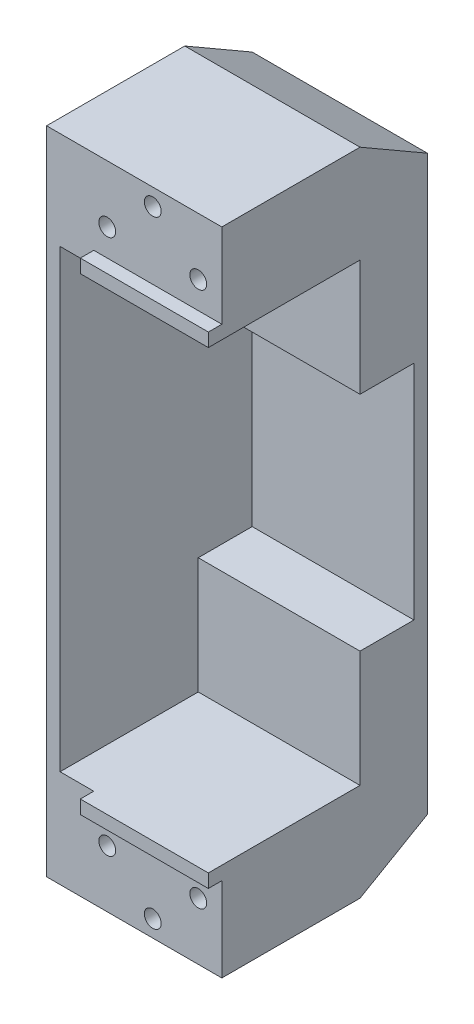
SolidWorks part; units mm, degrees
ref_plane "Спереди" through (0, 0, 0) normal (0, 0, 1) x (1, 0, 0)
ref_plane "Сверху" through (0, 0, 0) normal (0, 1, 0) x (1, 0, 0)
ref_plane "Справа" through (0, 0, 0) normal (1, 0, 0) x (0, 0, -1)
sketch "Эскиз1" plane through (0, 0, 0) normal (0, 1, 0) x (1, 0, 0)
  line L1 (-52, 0) -> (0, 0)
  line L2 (-52, 0) -> (-52, 61)
  line L3 (-52, 61) -> (0, 61)
  line L4 (0, 0) -> (0, 61)
  line L5 (-52, 0) -> (0, 61) construction
  line L6 (-52, 61) -> (0, 0) construction
  point P0 (0, 0)
  dimension "D1" = 61
  dimension "D2" = 52
extrude "Бобышка-Вытянуть1" add sketch "Эскиз1" against normal blind 29
sketch "Эскиз2" plane through (0, 0, 0) normal (0, 0, 1) x (1, 0, 0)
  line L1 (0, -29) -> (-38, -29)
  line L2 (0, -29) -> (0, -25)
  line L3 (0, -25) -> (-38, -25)
  line L4 (-38, -29) -> (-38, -25)
  dimension "D1" = 38
  dimension "D2" = 4
extrude "Бобышка-Вытянуть2" add sketch "Эскиз2" along normal blind 4
hole_wizard "Отверстие обработанное метчиком M6x1.01" positions "Эскиз3" profile "Эскиз4" tap size "M6x1.0" standard "Ansi Metric"
sketch "Эскиз3" plane through (0, 0, 0) normal (0, 0, 1) x (1, 0, 0)
  line L0 (-34, -17) -> (-7, -17) construction
  line L2 (-20.5, -17) -> (-20.5, -5) construction
  line L4 (-38, -29) -> (0, -29) construction
  line L5 (0, -25) -> (0, 0) construction
  point P0 (-34, -17)
  point P4 (-7, -17)
  point P8 (-20.5, -5)
  dimension "D1" = 27
  dimension "D2" = 12
  dimension "D3" = 12
  dimension "D4" = 7
sketch "Эскиз4" plane through (-34, -17, 0) normal (1, 0, 0) x (0, -1, 0)
  line L0 (0, 0) -> (0, 21.5022)
  line L1 (0, 21.5022) -> (2.5, 20)
  line L2 (2.5, 20) -> (2.5, 0)
  line L5 (2.5, 0) -> (0, 0)
  line L10 (0, 21.5022) -> (-2.5, 20) construction
  line L11 (0, -6.35) -> (0, 107.95) construction
  dimension "Диаметр сверла" = 5
  dimension "Глубина сверла" = 20
  dimension "Угол заточки сверла" = 118
sketch "Эскиз5" plane through (0, -29, 0) normal (0, -1, 0) x (1, 0, 0)
  line L0 (0, 4) -> (0, -61) construction
  line L1 (-52, -61) -> (0, -61)
  line L2 (-52, -61) -> (-52, -41)
  line L3 (-52, -41) -> (0, -41)
  line L4 (0, -61) -> (0, -41)
  dimension "D1" = 20
extrude "Бобышка-Вытянуть3" add sketch "Эскиз5" along normal blind 34.5
sketch "Эскиз6" plane through (0, -29, 0) normal (0, -1, 0) x (1, 0, 0)
  line L1 (0, -61) -> (-52, -61)
  line L8 (0, -61) -> (0, -57)
  line L9 (0, 0) -> (0, -61) construction
  line L10 (0, -57) -> (-48, -57)
  line L11 (-48, -57) -> (-48, 0)
  line L12 (-52, 0) -> (0, 0) construction
  line L13 (-48, 0) -> (-52, 0)
  line L14 (-52, 0) -> (-52, -61)
  dimension "D1" = 4
extrude "Бобышка-Вытянуть4" add sketch "Эскиз6" along normal blind 135
chamfer "Фаска1" distance 20 angle 30 1 edges at (-26, 0, -61)
ref_plane "Плоскость1" through (0, -96.5, 0) normal (0, -1, 0) x (-1, 0, 0)
mirror "Зеркальное отражение1" about plane through (0, -96.5, 0) normal (0, -1, 0) of "Фаска1", "Бобышка-Вытянуть3", "Отверстие обработанное метчиком M6x1.01", "Бобышка-Вытянуть2", "Бобышка-Вытянуть1"
